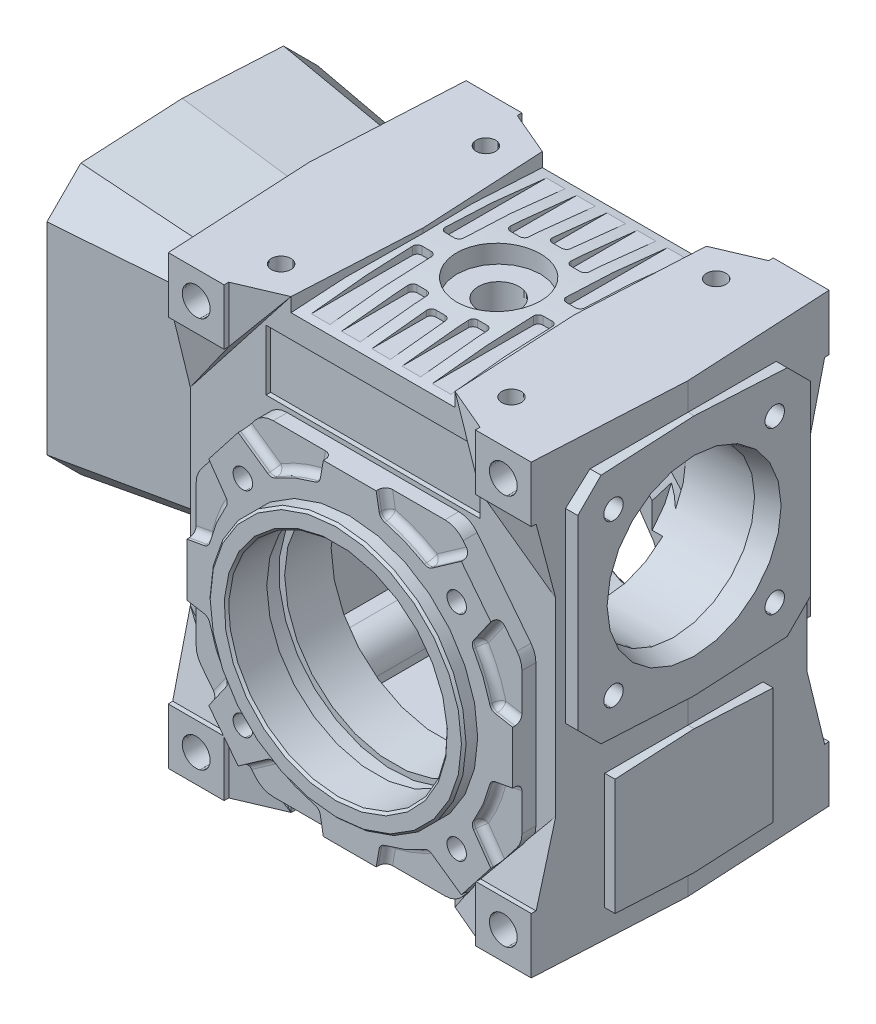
SolidWorks part; units mm, degrees
ref_plane "Plan de face" through (0, 0, 0) normal (0, 0, 1) x (1, 0, 0)
ref_plane "Plan de dessus" through (0, 0, 0) normal (0, 1, 0) x (1, 0, 0)
ref_plane "Plan de droite" through (0, 0, 0) normal (1, 0, 0) x (0, 0, -1)
imported_body "Importée1"
sketch "Esquisse1" plane through (0, 0, -9.5) normal (0, 0, 1) x (1, 0, 0)
  circle A1 centre (0, 0) radius 24.75
  circle A2 centre (0, 0) radius 24.75
  dimension "D1" = 0
extrude "Enlèv. mat.-Extru.1" cut sketch "Esquisse1" along normal blind 3.85
sketch "Esquisse2" plane through (0, 0, -54.5) normal (0, 0, -1) x (-1, 0, 0)
  circle A1 centre (0, 0) radius 24.75
  circle A2 centre (0, 0) radius 24.75
  dimension "D1" = 0
extrude "Enlèv. mat.-Extru.2" cut sketch "Esquisse2" along normal blind 3.85
